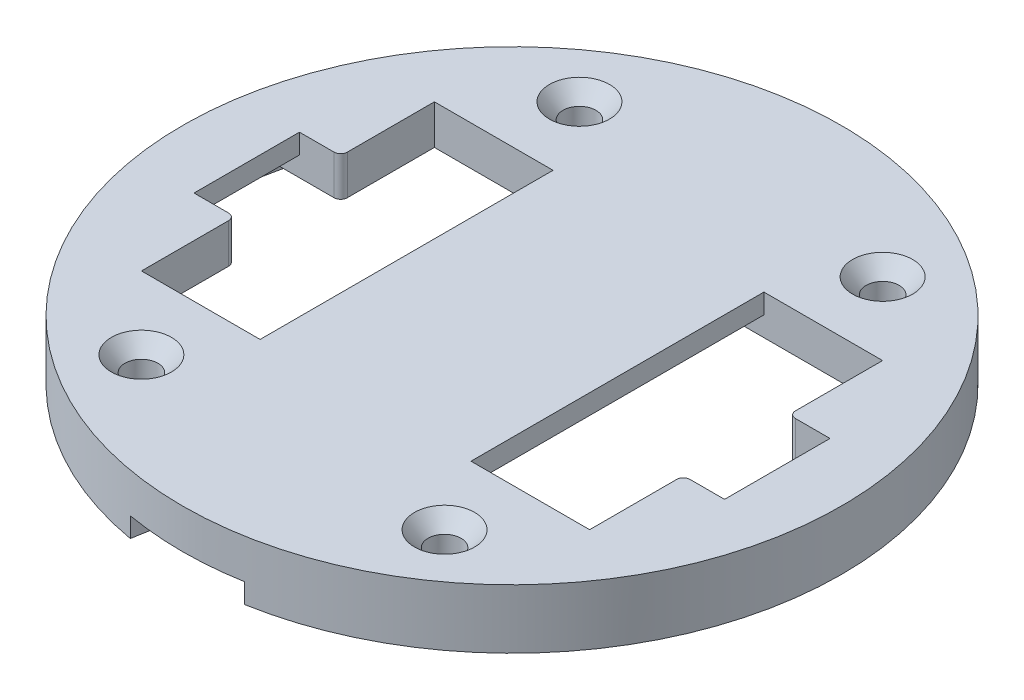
SolidWorks part; units mm, degrees
other "<a_base>-<Supports>"
ref_plane "Front Plane" through (0, 0, 0) normal (0, 0, 1) x (1, 0, 0)
ref_plane "Top Plane" through (0, 0, 0) normal (0, 1, 0) x (1, 0, 0)
ref_plane "Right Plane" through (0, 0, 0) normal (1, 0, 0) x (0, 0, -1)
inserted part "a_base"
sketch "Sketch1" plane through (0, 0, 0) normal (0, -1, 0) x (1, 0, 0)
  circle A0 centre (0, 0) radius 50 construction
  circle A1 centre (0, 0) radius 50
  circle A2 centre (0, 0) radius 47
  dimension "D1" = 3
extrude "Rim" add sketch "Sketch1" along normal blind 6
sketch "Sketch2" plane through (0, -6, 0) normal (0, -1, 0) x (1, 0, 0)
  line L0 (0, 0) -> (0, 50) construction
  line L1 (0, 0) -> (-50, 0) construction
  line L2 (0, 0) -> (-8.6824, 49.2404) construction
  line L3 (0, 0) -> (8.6824, 49.2404) construction
  line L4 (-8.6824, 49.2404) -> (-8.1615, 46.286)
  line L5 (8.6824, 49.2404) -> (8.1615, 46.286)
  line L6 (8.6824, -49.2404) -> (8.1615, -46.286)
  line L7 (-8.6824, -49.2404) -> (-8.1615, -46.286)
  circle A0 centre (0, 0) radius 50 construction
  circle A1 centre (0, 0) radius 47 construction
  arc A2 (8.6824, 49.2404) -> (-8.6824, 49.2404) centre (0, 0) ccw
  arc A3 (8.1615, 46.286) -> (-8.1615, 46.286) centre (0, 0) ccw
  arc A4 (8.1615, -46.286) -> (-8.1615, -46.286) centre (0, 0) cw
  arc A5 (8.6824, -49.2404) -> (-8.6824, -49.2404) centre (0, 0) cw
  dimension "D1" = 20
extrude "Flange Clearance" cut sketch "Sketch2" against normal blind 3
sketch "Sketch3" plane through (0, 0, 0) normal (0, -1, 0) x (1, 0, 0)
  line L0 (0, 47) -> (0, 0) construction
  line L1 (0, 0) -> (47, 0) construction
  line L2 (29.5, 36.5889) -> (29.5, -36.5889) construction
  line L3 (40.25, -8) -> (40.25, 8)
  line L4 (40.25, 8) -> (34, 8)
  line L5 (34, 8) -> (34, 22.225)
  line L6 (34, 22.225) -> (16, 22.225)
  line L7 (16, 22.225) -> (16, -22.225)
  line L8 (16, -22.225) -> (34, -22.225)
  line L9 (34, -22.225) -> (34, -8)
  line L10 (34, -8) -> (40.25, -8)
  line L11 (-34, -8) -> (-40.25, -8)
  line L12 (-40.25, -8) -> (-40.25, 8)
  line L13 (-40.25, 8) -> (-34, 8)
  line L14 (-34, 8) -> (-34, 22.225)
  line L15 (-34, -22.225) -> (-34, -8)
  line L16 (-16, -22.225) -> (-34, -22.225)
  line L17 (-16, 22.225) -> (-16, -22.225)
  line L18 (-34, 22.225) -> (-16, 22.225)
  circle A0 centre (0, 0) radius 47 construction
  point P5 (38.75, 0)
  dimension "D1" = 29.5
  dimension "D2" = 9.25
  dimension "D3" = 1.5
  dimension "D4" = 44.45
  dimension "D5" = 22.75
  dimension "D6" = 18
  dimension "D7" = 16
extrude "Finger Clearance" cut sketch "Sketch3" against normal through all
sketch "Sketch4" plane through (0, 0, 0) normal (0, -1, 0) x (1, 0, 0)
  line L8 (-34, -22.225) -> (-34, -8)
  line L9 (-34, -8) -> (-43.25, -8)
  line L10 (-43.25, -8) -> (-43.25, 8)
  line L11 (-43.25, 8) -> (-34, 8)
  line L12 (-34, 8) -> (-34, 22.225)
  line L13 (-34, 22.225) -> (-13, 22.225)
  line L14 (-13, 22.225) -> (-13, -22.225)
  line L15 (-13, -22.225) -> (-34, -22.225)
  line L16 (-34, 8) -> (-40.25, 8) construction
  line L17 (-40.25, 8) -> (-40.25, -8) construction
  line L18 (-16, -22.225) -> (-16, 22.225) construction
  line L19 (34, 22.225) -> (34, 8)
  line L20 (34, 8) -> (43.25, 8)
  line L21 (43.25, 8) -> (43.25, -8)
  line L22 (43.25, -8) -> (34, -8)
  line L23 (34, -8) -> (34, -22.225)
  line L24 (34, -22.225) -> (13, -22.225)
  line L25 (13, -22.225) -> (13, 22.225)
  line L26 (13, 22.225) -> (34, 22.225)
  line L27 (16, 22.225) -> (16, -22.225) construction
  line L28 (40.25, -8) -> (40.25, 8) construction
  line L29 (-36.0513, 25.225) -> (-10, 25.225)
  line L30 (-10, 25.225) -> (-10, -25.225)
  line L31 (-10, -25.225) -> (-36.0513, -25.225)
  line L32 (-40.25, 0) -> (-16, 0) construction
  line L33 (10, 25.225) -> (10, -25.225)
  line L34 (10, -25.225) -> (36.0513, -25.225)
  line L35 (10, 25.225) -> (36.0513, 25.225)
  line L36 (0, 44) -> (0, -44) construction
  arc A0 (-28.4921, 33.5291) -> (-36.0513, 25.225) centre (0, 0) ccw
  circle A1 centre (0, 0) radius 47 construction
  arc A2 (-28.4921, 33.5291) -> (-21.3413, 38.4779) centre (-23, 33.234) ccw
  circle A3 centre (-23, 33.234) radius 2.5 construction
  circle A4 centre (-23, 33.234) radius 2.5
  circle A5 centre (23, 33.234) radius 2.5 construction
  circle A6 centre (23, -33.234) radius 2.5 construction
  circle A7 centre (-23, -33.234) radius 2.5 construction
  circle A8 centre (23, 33.234) radius 2.5
  circle A9 centre (23, -33.234) radius 2.5
  circle A10 centre (-23, -33.234) radius 2.5
  arc A11 (21.3413, 38.4779) -> (28.4921, 33.5291) centre (23, 33.234) ccw
  arc A12 (28.4921, -33.5291) -> (21.3413, -38.4779) centre (23, -33.234) ccw
  arc A13 (-21.3413, -38.4779) -> (-28.4921, -33.5291) centre (-23, -33.234) ccw
  arc A14 (21.3413, 38.4779) -> (-21.3413, 38.4779) centre (0, 0) ccw
  arc A15 (28.4921, -33.5291) -> (36.0513, -25.225) centre (0, 0) ccw
  arc A16 (-21.3413, -38.4779) -> (21.3413, -38.4779) centre (0, 0) ccw
  circle A17 centre (0, 0) radius 47
  arc A18 (-36.0513, -25.225) -> (-28.4921, -33.5291) centre (0, 0) ccw
  arc A19 (36.0513, 25.225) -> (28.4921, 33.5291) centre (0, 0) ccw
  dimension "D1" = 3
  dimension "D2" = 3
  dimension "D3" = 3
  dimension "D4" = 3
  dimension "D5" = 3
  dimension "D6" = 3
  dimension "D7" = 3
  dimension "D8" = 3
extrude "Inset Layer" add sketch "Sketch4" along normal up to surface (3 mm away)
fillet "Contouring" radius 1 20 edges at (34, 0, -8) (34, 0, 8) (36.0513, -1.5, 25.225) (28.4921, -1.5, 33.5291) (21.3413, -1.5, 38.4779) (10, -1.5, 25.225) (36.0513, -1.5, -25.225) (10, -1.5, -25.225) (28.4921, -1.5, -33.5291) (21.3413, -1.5, -38.4779) (-21.3413, -1.5, -38.4779) (-28.4921, -1.5, -33.5291) (-36.0513, -1.5, -25.225) (-10, -1.5, -25.225) (-34, 0, -8) (-34, 0, 8) (-10, -1.5, 25.225) (-36.0513, -1.5, 25.225) (-21.3413, -1.5, 38.4779) (-28.4921, -1.5, 33.5291)
hole_wizard "CSK for #8 Flat Head Socket Cap Screw1" positions "Sketch6" profile "Sketch5" countersink size "#8" standard "ANSI Inch"
sketch "Sketch6" plane through (0, 3, 0) normal (0, 1, 0) x (1, 0, 0)
  point P0 (-23, 33.234)
  point P3 (23, 33.234)
  point P6 (23, -33.234)
  point P9 (-23, -33.234)
sketch "Sketch5" plane through (-23, 3, -33.234) normal (1, 0, 0) x (0, 0, 1)
  line L0 (0, 0) -> (0, 9)
  line L1 (0, 9) -> (2.2479, 9)
  line L2 (2.2479, 9) -> (2.2479, 2.659)
  line L3 (2.2479, 2.659) -> (4.5593, 0)
  line L5 (4.5593, 0) -> (0, 0)
  line L6 (-2.2479, 2.659) -> (-4.5593, 0) construction
  line L11 (0, -6.35) -> (0, 107.95) construction
  dimension "Thru Hole Dia." = 4.4958
  dimension "Thru Hole Depth" = 9
  dimension "Near C'Sink Dia." = 9.1186
  dimension "Near C'Sink Angle" = 82
ref_point "Ref Center"
equation "\"D1@Sketch1\" = \"width keep@values@params_print.sldprt\""
equation "\"D1@Rim\" = 2 * \"width keep@values@params_print.sldprt\""
equation "\"D3@Sketch3\" = \"width keep@values@params_print.sldprt\" / 2"
equation "\"D4@Sketch3\" = \"base depth@values@params_finger.sldprt\""
equation "\"D5@Sketch3\" = \"LB pivot@values@params_finger.sldprt\""
equation "\"D6@Sketch3\" = \"height@values@params_finger.sldprt\""
equation "\"D1@Sketch4\" = \"width keep@values@params_print.sldprt\""
equation "\"D2@Sketch4\" = \"width keep@values@params_print.sldprt\""
equation "\"D3@Sketch4\" = \"width keep@values@params_print.sldprt\""
equation "\"D4@Sketch4\" = \"width keep@values@params_print.sldprt\""
equation "\"D5@Sketch4\"= \"width keep@values@params_print.sldprt\""
equation "\"D6@Sketch4\" = \"width keep@values@params_print.sldprt\""
equation "\"D7@Sketch4\" = \"width keep@values@params_print.sldprt\""
equation "\"D8@Sketch4\" = \"width keep@values@params_print.sldprt\""
